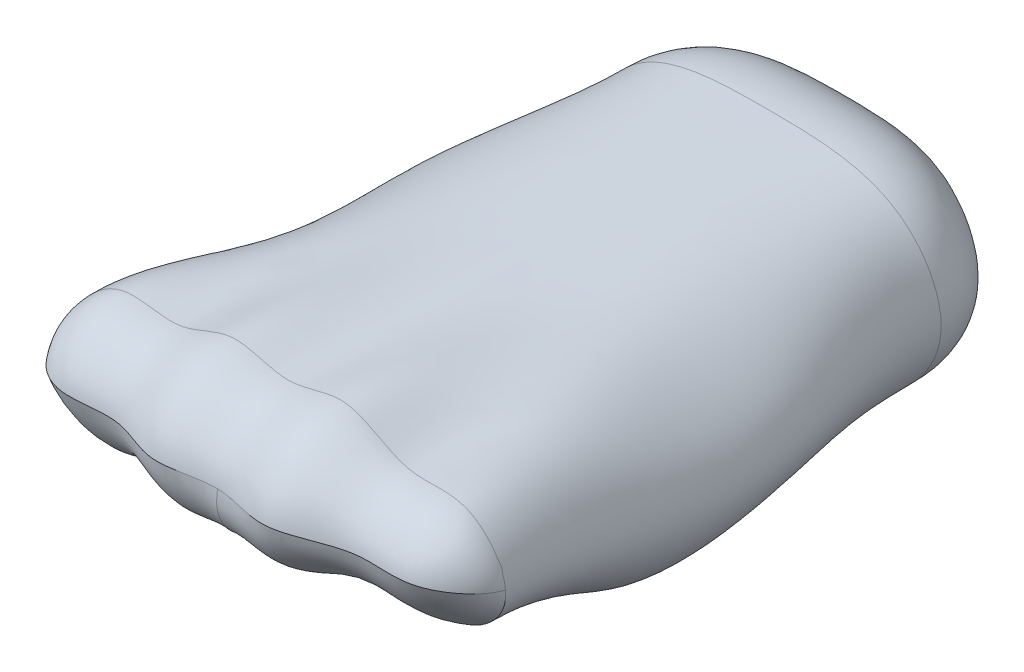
SolidWorks part; units mm, degrees
ref_plane "Front" through (0, 0, 0) normal (0, 0, 1) x (1, 0, 0)
ref_plane "Top" through (0, 0, 0) normal (0, 1, 0) x (1, 0, 0)
ref_plane "Right" through (0, 0, 0) normal (1, 0, 0) x (0, 0, -1)
sketch "Sketch1" plane through (0, 0, 0) normal (0, 0, 1) x (1, 0, 0)
  circle A0 centre (0, 0) radius 0.5
  dimension "D1" = 1
extrude "Base-Extrude" add sketch "Sketch1" along normal mid plane 1
other "Join1"
other "Hands-Left<1>@Hand-"
sketch "Sketch2" plane through (0, 7.9465, 0) normal (0, -1, 0) x (1, 0, 0)
  circle A0 centre (-26.3358, 78.5495) radius 5 construction
  circle A1 centre (-8.8286, 81.0431) radius 5 construction
  circle A2 centre (8.8286, 81.0431) radius 5 construction
  circle A3 centre (26.1239, 78.595) radius 5 construction
  circle A4 centre (-26.3358, 78.5495) radius 5.1
  circle A7 centre (-8.8286, 81.0431) radius 5.1
  circle A10 centre (8.8286, 81.0431) radius 5.1
  circle A13 centre (26.1239, 78.595) radius 5.1
  dimension "D1" = 10.2
extrude "Cut-Extrude1" cut sketch "Sketch2" along normal up to surface (3 mm away)
sketch "Sketch3" plane through (-7.1426, 0, -0.8833) normal (0.9924, 0, 0.1227) x (0.1227, 0, -0.9924)
  circle A0 centre (-14.1213, -4.5689) radius 5 construction
  circle A3 centre (-14.1213, -4.5689) radius 5.1
  dimension "D1" = 10.2
extrude "Cut-Extrude2" cut sketch "Sketch3" against normal up to surface (1 mm away)
